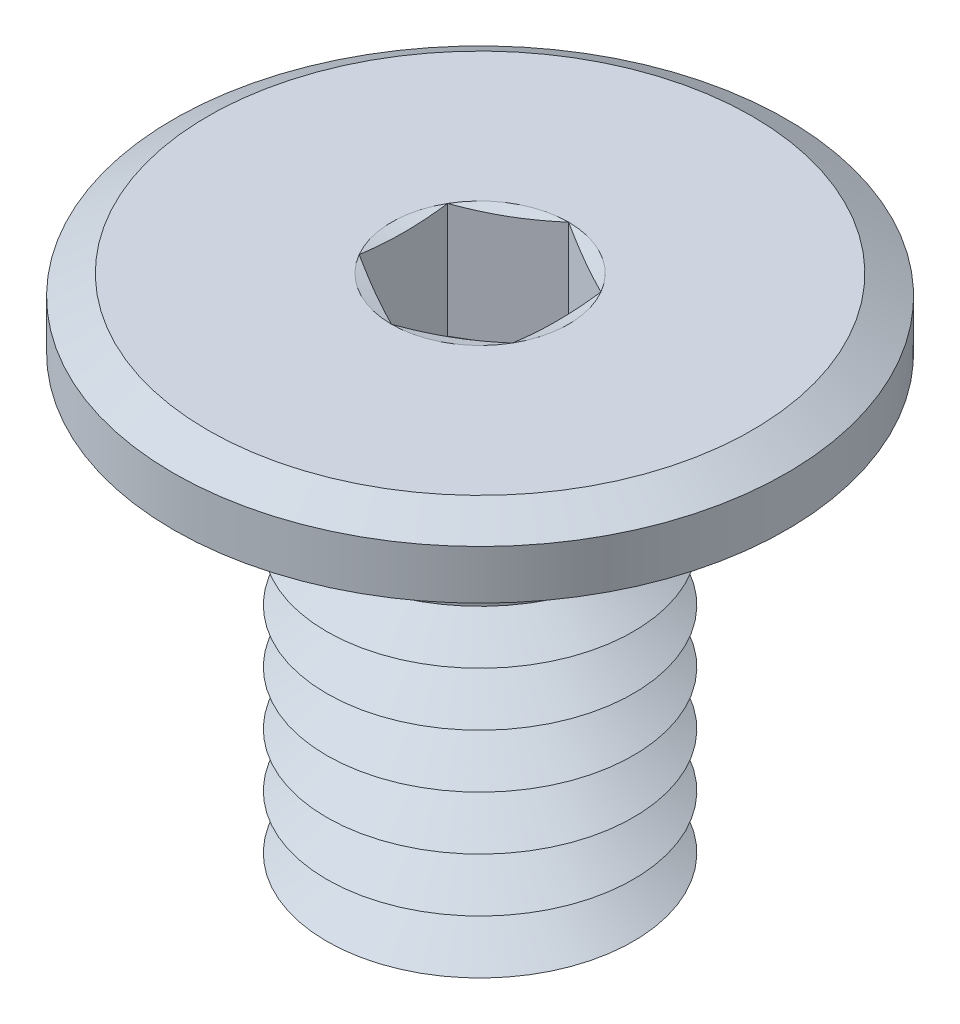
SolidWorks part; units mm, degrees
ref_plane "Front Plane" through (0, 0, 0) normal (0, 0, 1) x (1, 0, 0)
ref_plane "Top Plane" through (0, 0, 0) normal (0, 1, 0) x (1, 0, 0)
ref_plane "Right Plane" through (0, 0, 0) normal (1, 0, 0) x (0, 0, -1)
sketch "Sketch1" plane through (0, 0, 0) normal (0, 1, 0) x (1, 0, 0)
  circle A0 centre (0, 0) radius 4
  dimension "D1" = 8
extrude "Boss-Extrude1" add sketch "Sketch1" against normal blind 0.9
sketch "Sketch2" plane through (0, -0.9, 0) normal (0, -1, 0) x (1, 0, 0)
  circle A0 centre (0, 0) radius 2
  dimension "D1" = 4
extrude "Boss-Extrude2" add sketch "Sketch2" along normal blind 6
sketch "Sketch3" plane through (0, 0, 0) normal (1, 0, 0) x (0, 0, -1)
  line L0 (0, 0.9906) -> (0, -8.2999) construction
sketch "Sketch5" plane through (0, 0, 0) normal (1, 0, 0) x (0, 0, -1)
  line L0 (-2, -7.25) -> (-1.3938, -6.9)
  line L1 (-2, -0.9) -> (-2, -6.9) construction
  line L2 (-1.3938, -6.9) -> (-2, -6.55)
  line L3 (-2, -0.9) -> (-2, -6.9) construction
  line L4 (-2, -6.55) -> (-2, -7.25)
  line L6 (-2, -0.9) -> (-2, -6.9) construction
  line L7 (-2, -0.9) -> (-2, -6.9) construction
  line L14 (-2, -6.9) -> (2, -6.9) construction
  dimension "D1" = 0.7
revolve "Cut-Revolve1" cut sketch "Sketch5" angle 360 about L0
pattern_linear "LPattern1" count 7 spacing 0.7 along (0, 1, 0) of "Cut-Revolve1"
fillet "Fillet1" radius 0.2 1 edges at (0, -0.9, -2)
chamfer "Chamfer2" distance 0.45 angle 30 1 edges at (0, 0, 4)
sketch "Sketch6" plane through (0, 0, 0) normal (0, 1, 0) x (1, 0, 0)
  line L1 (0, 1.1547) -> (-1, 0.5774)
  line L2 (-1, 0.5774) -> (-1, -0.5774)
  line L3 (-1, -0.5774) -> (0, -1.1547)
  line L4 (0, -1.1547) -> (1, -0.5774)
  line L5 (1, -0.5774) -> (1, 0.5774)
  line L6 (1, 0.5774) -> (0, 1.1547)
  circle A0 centre (0, 0) radius 1 construction
  dimension "D1" = 2
extrude "Cut-Extrude1" cut sketch "Sketch6" against normal blind 1.5
sketch "Sketch7" plane through (0, -1.5, 0) normal (0, 1, 0) x (1, 0, 0)
  line L0 (-1, 0.5774) -> (-1, -0.5774) construction
  circle A0 centre (0, 0) radius 1
extrude "Cut-Extrude2" cut sketch "Sketch7" against normal through all draft 60
sketch "Sketch8" plane through (0, 0, 0) normal (0, 1, 0) x (1, 0, 0)
  circle A0 centre (0, 0) radius 1.1547
extrude "Cut-Extrude3" cut sketch "Sketch8" against normal through all draft 75
